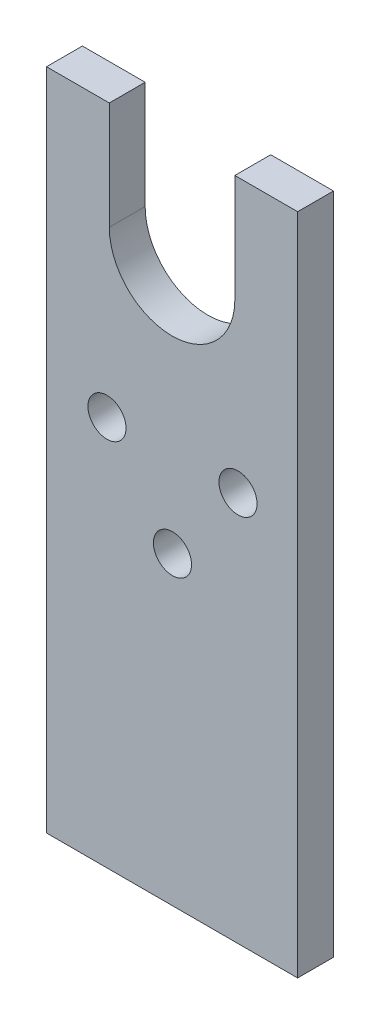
SolidWorks part; units mm, degrees
ref_plane "Plane1" through (0, 0, 0) normal (0, 0, 1) x (1, 0, 0)
ref_plane "Plane2" through (0, 0, 0) normal (0, 1, 0) x (1, 0, 0)
ref_plane "Plane3" through (0, 0, 0) normal (1, 0, 0) x (0, 0, -1)
sketch "Sketch1"
  dimension "D1" = 234.95
  dimension "D2" = 6.35
  dimension "D3" = 6.35
  dimension "D4" = 139.7
extrude "Base-Extrude" add sketch "Sketch1" along normal blind 12.7
sketch "Sketch2"
  dimension "D1" = 13.4874
  dimension "D2" = 46.3876
  dimension "D3" = 30.2268
  dimension "D4" = 96.774
  dimension "D5" = 21.1074
  dimension "D6" = 122.1469
extrude "Cut-Extrude1" cut sketch "Sketch2" against normal through all
sketch "Sketch3"
  dimension "D1" = 44.45
  dimension "D2" = 38.1
  dimension "D3" = 44.45
  dimension "D4" = 46.5553
extrude "Cut-Extrude2" cut sketch "Sketch3" against normal through all
